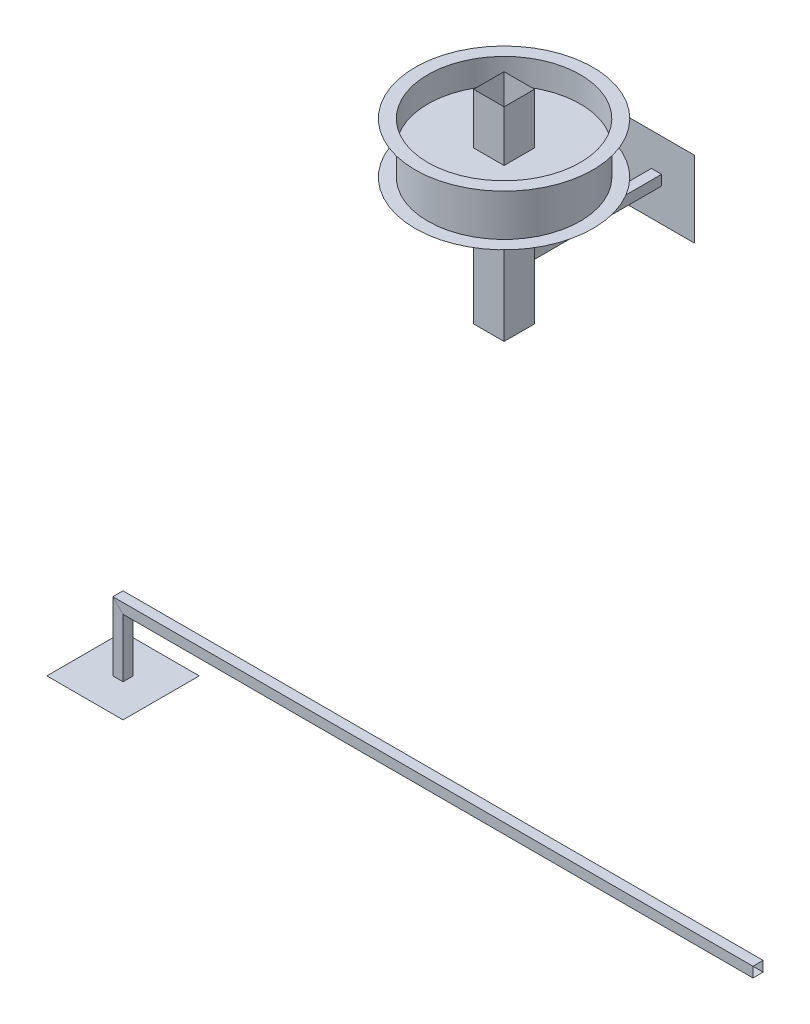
SolidWorks part; units mm, degrees
ref_plane "Plan de face" through (0, 0, 0) normal (0, 0, 1) x (1, 0, 0)
ref_plane "Plan de dessus" through (0, 0, 0) normal (0, 1, 0) x (1, 0, 0)
ref_plane "Plan de droite" through (0, 0, 0) normal (1, 0, 0) x (0, 0, -1)
sketch "Esquisse2" plane through (0, 0, 0) normal (0, 0, 1) x (1, 0, 0)
  line L0 (100, 0) -> (-150, 0)
  line L1 (-150, 0) -> (-150, -25)
  dimension "D1" = 25
  dimension "D2" = 250
  dimension "D3" = 100
ref_plane "Plan4" through (100, 0, 0) normal (1, 0, 0) x (0, 0, -1)
sketch "Esquisse3" plane through (100, 0, 0) normal (1, 0, 0) x (0, 0, -1)
  line L0 (2, 2) -> (-2, -2) construction
  line L1 (2, 2) -> (-2, 2)
  line L2 (2, 2) -> (2, -2)
  line L3 (2, -2) -> (-2, -2)
  line L4 (-2, 2) -> (-2, -2)
  dimension "D1" = 45
  dimension "D2" = 4
surface "Surface-Balayage1"
ref_plane "Plan5" through (0, -25, 0) normal (0, 1, 0) x (-1, 0, 0)
sketch "Esquisse4" plane through (0, -25, 0) normal (0, 1, 0) x (-1, 0, 0)
  line L0 (165, -15) -> (135, 15) construction
  line L1 (165, -15) -> (135, -15)
  line L2 (165, -15) -> (165, 15)
  line L3 (165, 15) -> (135, 15)
  line L4 (135, -15) -> (135, 15)
  line L5 (152, -2) -> (148, 2) construction
  point P8 (150, 0)
  dimension "D1" = 30
surface "Surface-Plan1" sketch "Esquisse4"
ref_plane "Plan6" through (0, 210, 0) normal (0, 1, 0) x (-1, 0, 0)
sketch "Esquisse5" plane through (0, 210, 0) normal (0, 1, 0) x (-1, 0, 0)
  line L0 (6, -6) -> (-6, 6) construction
  line L1 (6, -6) -> (-6, -6)
  line L2 (6, -6) -> (6, 6)
  line L3 (6, 6) -> (-6, 6)
  line L4 (-6, -6) -> (-6, 6)
  dimension "D1" = 45
  dimension "D2" = 12
surface "Surface-Extrusion1" sketch "Esquisse5" parameters "D1"=80
ref_plane "Plan7" through (0, 230, 0) normal (0, 1, 0) x (-1, 0, 0)
sketch "Esquisse6" plane through (0, 230, 0) normal (0, 1, 0) x (-1, 0, 0)
  circle A0 centre (0, 0) radius 30
  dimension "D1" = 60
surface "Surface-Extrusion2" sketch "Esquisse6" parameters "D1"=20
sketch "Esquisse7" plane through (0, 230, 0) normal (0, 1, 0) x (-1, 0, 0)
  line L0 (6, 6) -> (6, -6) construction
  line L1 (-6, 6) -> (6, 6) construction
  line L2 (-6, -6) -> (-6, 6) construction
  line L3 (6, -6) -> (-6, -6) construction
  line L4 (6, 6) -> (6, -6)
  line L5 (-6, 6) -> (6, 6)
  line L6 (-6, -6) -> (-6, 6)
  line L7 (6, -6) -> (-6, -6)
  circle A0 centre (0, 0) radius 30 construction
  circle A1 centre (0, 0) radius 30
surface "Surface-Plan2" sketch "Esquisse7"
ref_plane "Plan8" through (0, 240, 0) normal (0, 1, 0) x (-1, 0, 0)
sketch "Esquisse8" plane through (0, 240, 0) normal (0, 1, 0) x (-1, 0, 0)
  circle A0 centre (0, 0) radius 30 construction
  circle A1 centre (0, 0) radius 30
  circle A2 centre (0, 0) radius 35
  dimension "D1" = 70
surface "Surface-Plan3" sketch "Esquisse8"
ref_plane "Plan9" through (0, 220, 0) normal (0, 1, 0) x (-1, 0, 0)
sketch "Esquisse9" plane through (0, 220, 0) normal (0, 1, 0) x (-1, 0, 0)
  circle A0 centre (0, 0) radius 35
  circle A1 centre (0, 0) radius 30 construction
  circle A2 centre (0, 0) radius 30
  dimension "D1" = 70
surface "Surface-Plan4" sketch "Esquisse9"
sketch "Esquisse10" plane through (0, 0, 0) normal (0, 0, 1) x (1, 0, 0)
  line L0 (-2, 192) -> (2, 188) construction
  line L1 (-2, 192) -> (2, 192)
  line L2 (-2, 192) -> (-2, 188)
  line L3 (-2, 188) -> (2, 188)
  line L4 (2, 192) -> (2, 188)
  line L5 (-6, 170) -> (6, 170) construction
  point P4 (0, 190)
  dimension "D1" = 4
  dimension "D2" = 45
  dimension "D3" = 20
surface "Surface-Extrusion3" sketch "Esquisse10" parameters "D1"=60
ref_plane "Plan10" through (0, 0, -60) normal (0, 0, 1) x (1, 0, 0)
sketch "Esquisse11" plane through (0, 0, -60) normal (0, 0, 1) x (1, 0, 0)
  line L0 (15, 205) -> (-15, 175) construction
  line L1 (15, 205) -> (-15, 205)
  line L2 (15, 205) -> (15, 175)
  line L3 (15, 175) -> (-15, 175)
  line L4 (-15, 205) -> (-15, 175)
  line L5 (-2, 192) -> (2, 188) construction
  point P8 (0, 190)
  dimension "D1" = 45
  dimension "D2" = 30
surface "Surface-Plan5" sketch "Esquisse11"
